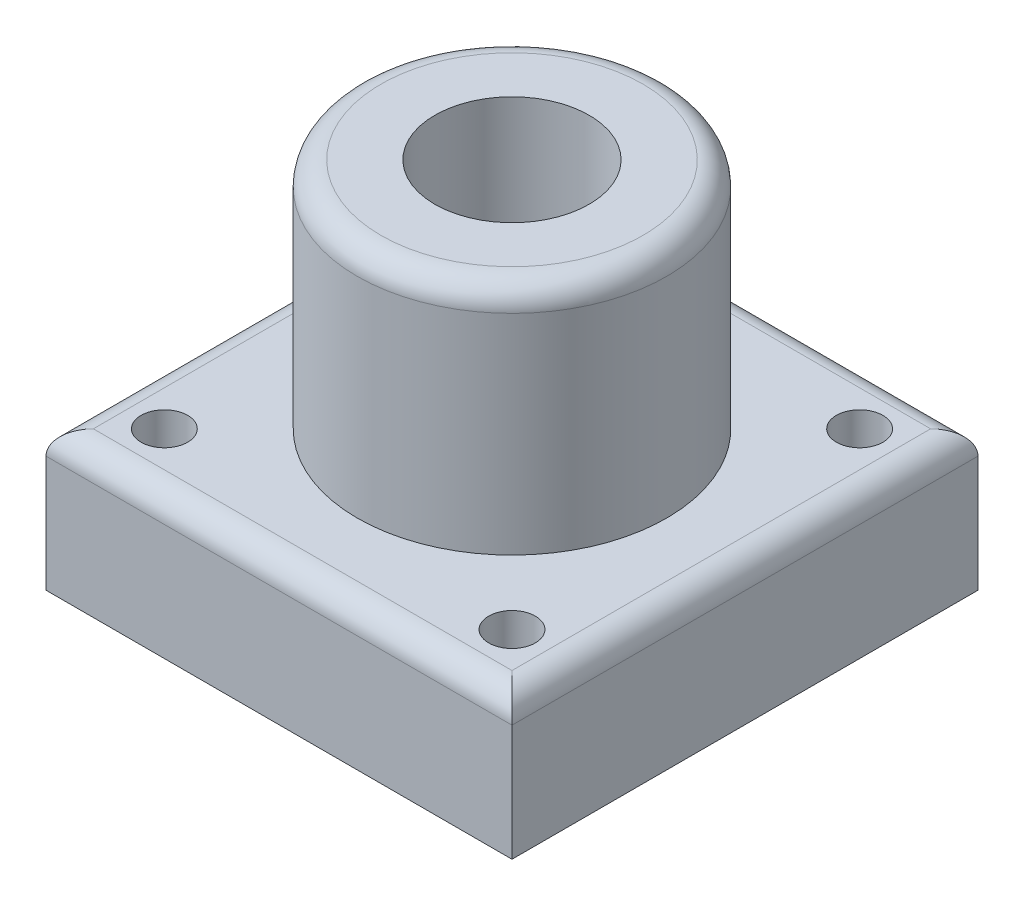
SolidWorks part; units mm, degrees
ref_plane "Front Plane" through (0, 0, 0) normal (0, 0, 1) x (1, 0, 0)
ref_plane "Top Plane" through (0, 0, 0) normal (0, 1, 0) x (1, 0, 0)
ref_plane "Right Plane" through (0, 0, 0) normal (1, 0, 0) x (0, 0, -1)
sketch "Sketch1" plane through (0, 0, 0) normal (0, 1, 0) x (1, 0, 0)
  line L1 (-23.8189, 17.8642) -> (26.1811, 17.8642)
  line L2 (-23.8189, 17.8642) -> (-23.8189, -32.1358)
  line L3 (-23.8189, -32.1358) -> (26.1811, -32.1358)
  line L4 (26.1811, 17.8642) -> (26.1811, -32.1358)
  dimension "D1" = 50
  dimension "D2" = 50
extrude "Boss-Extrude1" add sketch "Sketch1" along normal blind 15
sketch "Sketch3" plane through (0, 15, 0) normal (0, 1, 0) x (1, 0, 0)
  line L0 (-23.8189, 17.8642) -> (-23.8189, -32.1358) construction
  line L1 (-23.8189, -32.1358) -> (26.1811, -32.1358) construction
  circle A0 centre (1.1811, -7.1358) radius 16.6
  point P6 (-55.891, 0.0789)
  dimension "D3" = 33.2
  dimension "D1" = 25
  dimension "D2" = 25
extrude "Boss-Extrude2" add sketch "Sketch3" along normal blind 25
sketch "Sketch4" plane through (0, 15, 0) normal (0, 1, 0) x (1, 0, 0)
  line L0 (1.1811, 17.8642) -> (1.1811, -35.6001) construction
  line L1 (26.1811, 17.8642) -> (-23.8189, 17.8642) construction
  line L2 (-23.8189, 17.8642) -> (-23.8189, -32.1358) construction
  circle A0 centre (-17.4689, 11.5142) radius 2.5
  circle A1 centre (19.8311, 11.5142) radius 2.5
  circle A2 centre (19.8311, -25.7858) radius 2.5
  circle A3 centre (-17.4689, -25.7858) radius 2.5
  dimension "D1" = 5
  dimension "D2" = 6.35
  dimension "D3" = 6.35
  dimension "D4" = 2
extrude "Cut-Extrude1" cut sketch "Sketch4" against normal through all
sketch "Sketch5" plane through (0, 40, 0) normal (0, 1, 0) x (1, 0, 0)
  circle A0 centre (1.1811, -7.1358) radius 8.28
  dimension "D1" = 16.56
extrude "Cut-Extrude2" cut sketch "Sketch5" against normal through all
fillet "Fillet1" radius 2.54 5 edges at (1.1811, 40, 23.7358) (1.1811, 15, 32.1358) (26.1811, 15, 7.1358) (1.1811, 15, -17.8642) (-23.8189, 15, 7.1358)
